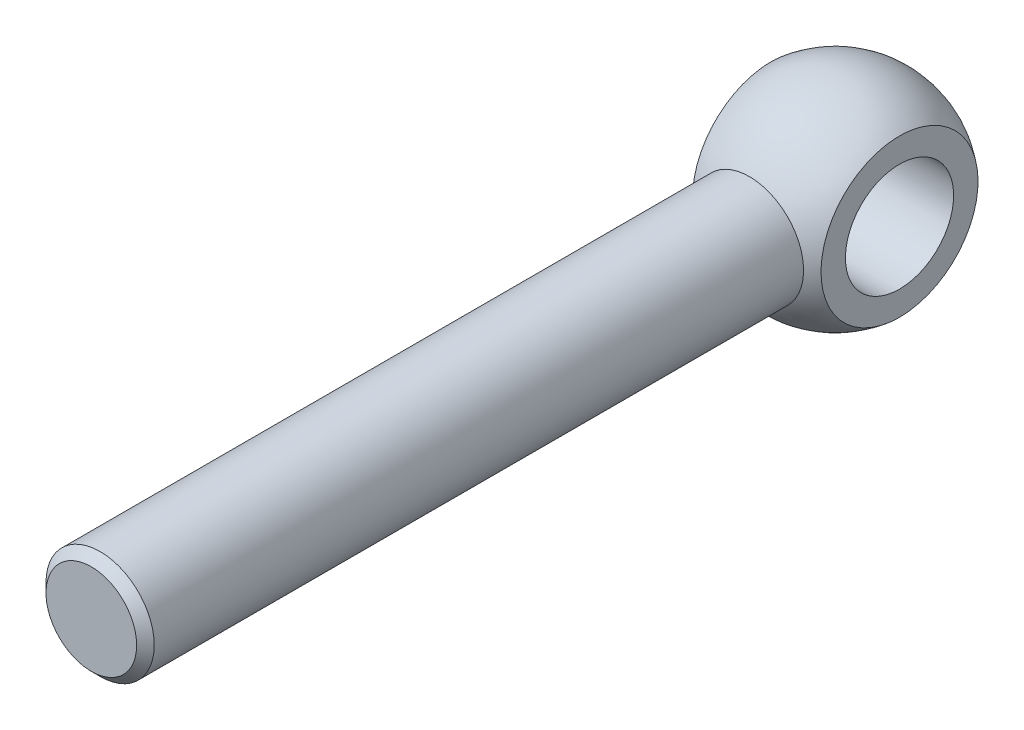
SolidWorks part; units mm, degrees
ref_plane "Plan de face" through (0, 0, 0) normal (0, 0, 1) x (1, 0, 0)
ref_plane "Plan de dessus" through (0, 0, 0) normal (0, 1, 0) x (1, 0, 0)
ref_plane "Plan de droite" through (0, 0, 0) normal (1, 0, 0) x (0, 0, -1)
sketch "Esquisse1" plane through (0, 0, 0) normal (0, 0, 1) x (1, 0, 0)
  line L0 (0, 0) -> (0, 12.0376) construction
  line L1 (0, 7.5) -> (0, -7.5)
  arc A0 (0, 7.5) -> (0, -7.5) centre (0, 0) ccw
  dimension "D1" = 7.5
revolve "Révolution1" add sketch "Esquisse1" angle 360 about L0
sketch "Esquisse2" plane through (0, 0, 0) normal (0, 0, 1) x (1, 0, 0)
  line L1 (-9.6796, 7.2081) -> (-4.75, 7.2081)
  line L2 (-9.6796, 7.2081) -> (-9.6796, -8.5265)
  line L3 (-9.6796, -8.5265) -> (-4.75, -8.5265)
  line L4 (-4.75, 7.2081) -> (-4.75, -8.5265)
  line L5 (4.75, 7.2081) -> (11.3133, 7.2081)
  line L6 (4.75, 7.2081) -> (4.75, -8.5265)
  line L7 (4.75, -8.5265) -> (11.3133, -8.5265)
  line L8 (11.3133, 7.2081) -> (11.3133, -8.5265)
  dimension "D1" = 9.5
  dimension "D2" = 4.75
extrude "Enlèv. mat.-Extru.1" cut sketch "Esquisse2" against normal through all and the other way through all
sketch "Esquisse3" plane through (0, 0, 0) normal (0, 0, 1) x (1, 0, 0)
  circle A0 centre (0, 0) radius 4
  dimension "D1" = 8
extrude "Boss.-Extru.1" add sketch "Esquisse3" along normal blind 55
chamfer "Chanfrein1" distance 0.65 angle 45 1 edges at (4, 0, 55)
sketch "Esquisse4" plane through (-4.75, 0, 0) normal (-1, 0, 0) x (0, 0, 1)
  circle A0 centre (0, 0) radius 4
  dimension "D1" = 8
extrude "Enlèv. mat.-Extru.2" cut sketch "Esquisse4" against normal through all
